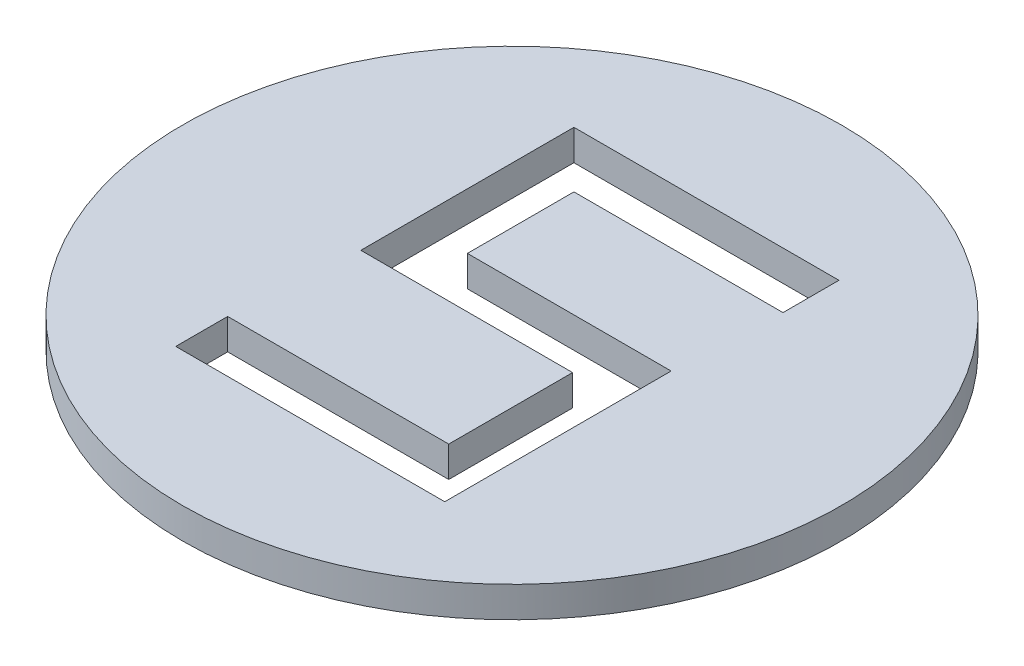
SolidWorks part; units mm, degrees
ref_plane "Front Plane" through (0, 0, 0) normal (0, 0, 1) x (1, 0, 0)
ref_plane "Top Plane" through (0, 0, 0) normal (0, 1, 0) x (1, 0, 0)
ref_plane "Right Plane" through (0, 0, 0) normal (1, 0, 0) x (0, 0, -1)
sketch "Sketch1" plane through (0, 0, 0) normal (0, 1, 0) x (1, 0, 0)
  circle A0 centre (0, 7.7315) radius 42.9395
extrude "Boss-Extrude1" add sketch "Sketch1" along normal blind 4
sketch "Sketch2" plane through (0, 4, 0) normal (0, 1, 0) x (1, 0, 0)
  line L0 (17.3518, 32.9784) -> (-17.1783, 32.9784)
  line L1 (-17.1783, 32.9784) -> (-17.1783, 5.2155)
  line L2 (-17.1783, 5.2155) -> (10.4111, 5.2155)
  line L3 (10.4111, 5.2155) -> (10.4111, -10.9216)
  line L4 (10.4111, -10.9216) -> (-18.3929, -10.9216)
  line L5 (17.3518, 25.6906) -> (17.3518, 32.9784)
  line L6 (17.3518, 25.6906) -> (-9.8905, 25.6906)
  line L7 (-9.8905, 25.6906) -> (-9.8905, 11.8092)
  line L8 (-9.8905, 11.8092) -> (16.6577, 11.8092)
  line L9 (16.6577, 11.8092) -> (16.6577, -17.6888)
  line L10 (16.6577, -17.6888) -> (-18.3929, -17.6888)
  line L11 (-18.3929, -17.6888) -> (-18.3929, -10.9216)
extrude "Cut-Extrude1" cut sketch "Sketch2" against normal blind 4
